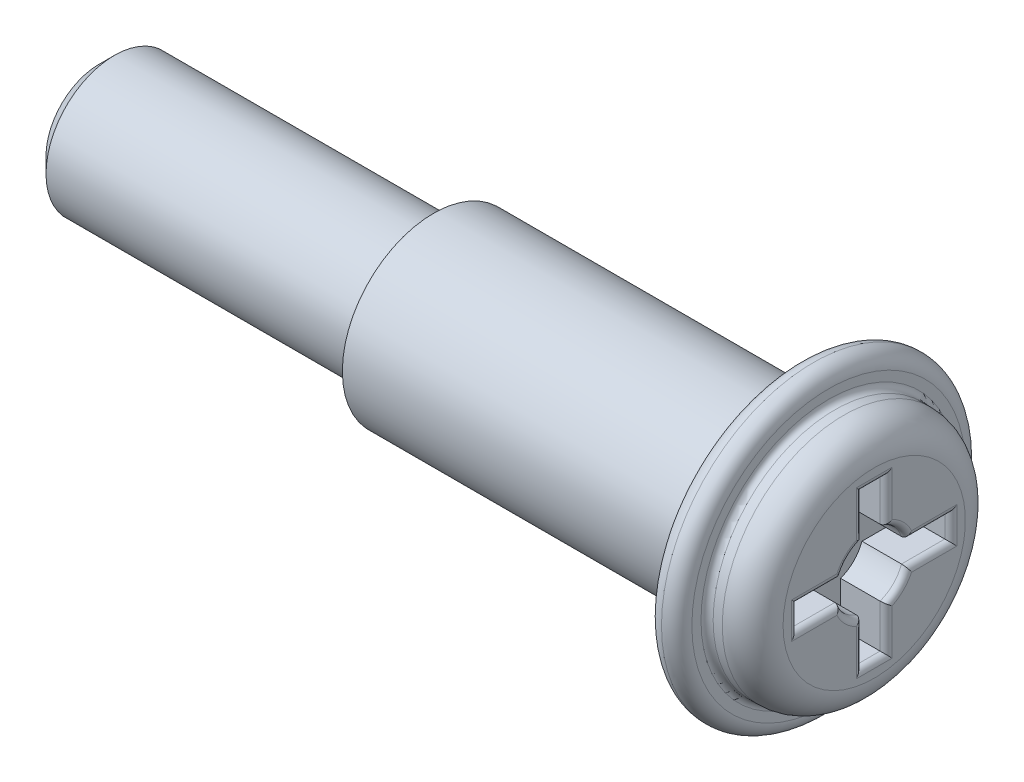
SolidWorks part; units mm, degrees
ref_plane "Face" through (0, 0, 0) normal (0, 0, 1) x (1, 0, 0)
ref_plane "Dessus" through (0, 0, 0) normal (0, 1, 0) x (1, 0, 0)
ref_plane "Droite" through (0, 0, 0) normal (1, 0, 0) x (0, 0, -1)
sketch "Esquisse1" plane through (0, 0, 0) normal (0, 0, 1) x (1, 0, 0)
  line L0 (0, 0) -> (25.5, 0) construction
  line L1 (0, 0) -> (0, 2.25)
  line L2 (0, 2.25) -> (11, 2.25)
  line L3 (11, 2.25) -> (11, 3)
  line L4 (11, 3) -> (23, 3)
  line L5 (23, 3) -> (23, 5)
  line L6 (23, 5) -> (24, 5)
  line L7 (24, 5) -> (24, 4)
  line L8 (24, 4) -> (24.5, 4)
  line L9 (25.5, 3) -> (25.5, 0)
  line L10 (0, 0) -> (25.5, 0)
  arc A0 (25.5, 3) -> (24.5, 4) centre (24.5, 3) ccw
  point P13 (25.5, 4)
  dimension "D9" = 1
  dimension "D1" = 4.5
  dimension "D2" = 11
  dimension "D3" = 6
  dimension "D4" = 12
  dimension "D5" = 10
  dimension "D6" = 1
  dimension "D7" = 1.5
  dimension "D8" = 4
revolve "Révolution1" add sketch "Esquisse1" angle 360 about L0
fillet "Congé1" radius 0.5
fillet "Congé2" radius 0.2
sketch "Esquisse2" plane through (25.5, 0, 0) normal (1, 0, 0) x (0, 0, -1)
  line L0 (0, 0) -> (0, 2.4814) construction
  line L1 (0.3918, 0) -> (-0.3918, 0)
  line L2 (-0.3918, 0) -> (-0.3918, 2.521)
  line L3 (0.3918, 0) -> (0.3918, 2.521)
  line L4 (-0.3918, 2.521) -> (0.3918, 2.521)
  point P8 (0, 2.521)
extrude "Enlèv. mat.-Extru.1" cut sketch "Esquisse2" against normal blind 1.5
pattern_circular "Répétition circulaire1" count 4 over 360 about axis through (0, 0, 0) along (1, 0, 0)
sketch "Esquisse3" plane through (25.5, 0, 0) normal (1, 0, 0) x (0, 0, -1)
  circle A0 centre (0, 0) radius 1.164
extrude "Enlèv. mat.-Extru.2" cut sketch "Esquisse3" against normal up to surface (1.5 mm away)
fillet "Congé3" radius 0.2
chamfer "Chanfrein1" distance 0.5 angle 45
